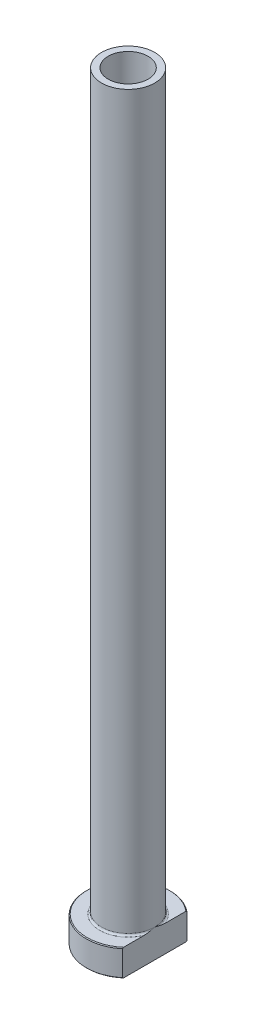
SolidWorks part; units mm, degrees
ref_plane "Front Plane" through (0, 0, 0) normal (0, 0, 1) x (1, 0, 0)
ref_plane "Top Plane" through (0, 0, 0) normal (0, 1, 0) x (1, 0, 0)
ref_plane "Right Plane" through (0, 0, 0) normal (1, 0, 0) x (0, 0, -1)
sketch "Sketch1" plane through (0, 0, 0) normal (0, 0, 1) x (1, 0, 0)
  line L0 (-5.25, 200) -> (-7, 200)
  line L1 (-7, 200) -> (-7, 7)
  line L2 (-7, 7) -> (-11, 7)
  line L3 (-11, 7) -> (-11, 0)
  line L4 (9.9, 0) -> (-9.9, 0) construction
  line L5 (-11, 0) -> (-5.5, 0)
  line L6 (-5.25, 145) -> (-5.25, 200)
  line L7 (0, 92.1877) -> (0, -15.5353) construction
  line L8 (0, -12.1) -> (0, 12.1) construction
  line L9 (-5.25, 145) -> (-5.5, 133)
  line L10 (-5.5, 133) -> (-5.5, 0)
  dimension "D1" = 0.25
  dimension "ID" = 10.5
  dimension "OD" = 14
  dimension "L" = 200
  dimension "H" = 22
  dimension "T" = 7
  dimension "N" = 55
  dimension "D2" = 12
  dimension "L-N" = 145
revolve "Revolve1" add sketch "Sketch1" angle 360 about L7
fillet "Fillet1" radius 0.5 1 edges at (0, 7, 7)
chamfer "Chamfer1" distance 0.2 angle 45 2 edges at (0, 7, 11) (0, 0, 11)
sketch "Sketch2" plane through (0, 0, 0) normal (0, -1, 0) x (1, 0, 0)
  line L0 (7, 8.4853) -> (7, -8.4853)
  circle A0 centre (0, 0) radius 11 construction
  arc A1 (7, 8.4853) -> (7, -8.4853) centre (0, 0) cw
  circle A2 centre (0, 0) radius 7 construction
extrude "Cut-Extrude1" cut sketch "Sketch2" against normal through all
chamfer "Chamfer2" distance 0.5 angle 45 1 edges at (0, 0, 5.5)
